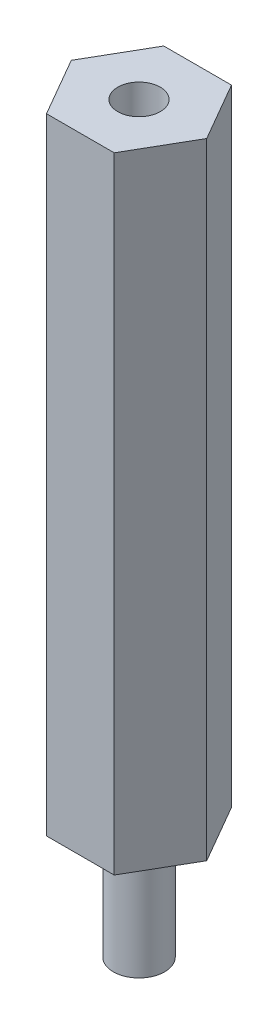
SolidWorks part; units mm, degrees
ref_plane "Front" through (0, 0, 0) normal (0, 0, 1) x (1, 0, 0)
ref_plane "Top" through (0, 0, 0) normal (0, 1, 0) x (1, 0, 0)
ref_plane "Right" through (0, 0, 0) normal (1, 0, 0) x (0, 0, -1)
sketch "Sketch1" plane through (0, 0, 0) normal (0, 1, 0) x (1, 0, 0)
  line L1 (5.4993, 0) -> (2.7496, 4.7625)
  line L2 (2.7496, 4.7625) -> (-2.7496, 4.7625)
  line L3 (-2.7496, 4.7625) -> (-5.4993, 0)
  line L4 (-5.4993, 0) -> (-2.7496, -4.7625)
  line L5 (-2.7496, -4.7625) -> (2.7496, -4.7625)
  line L6 (2.7496, -4.7625) -> (5.4993, 0)
  circle A1 centre (0, 0) radius 4.7625 construction
  dimension "D1" = 9.525
extrude "Base-Extrude" add sketch "Sketch1" along normal blind 50.8
sketch "Sketch2" plane through (0, 0, 0) normal (0, -1, 0) x (1, 0, 0)
  circle A0 centre (0, 0) radius 2.0828
  dimension "D1" = 4.1656
extrude "Extrude1" add sketch "Sketch2" along normal blind 9.525
hole_wizard "#8-32 Tapped Hole1" positions "Sketch4" profile "Sketch3" tap size "#8-32" standard "Ansi Inch"
sketch "Sketch4" plane through (0, 50.8, 0) normal (0, 1, 0) x (-1, 0, 0)
  point P0 (0, 0)
sketch "Sketch3" plane through (0, 50.8, 0) normal (1, 0, 0) x (0, 0, 1)
  line L0 (0, 0) -> (0, 14.9062)
  line L1 (0, 14.9062) -> (1.7272, 13.8684)
  line L2 (1.7272, 13.8684) -> (1.7272, 0)
  line L5 (1.7272, 0) -> (0, 0)
  line L10 (0, 14.9062) -> (-1.7272, 13.8684) construction
  line L11 (0, -6.35) -> (0, 107.95) construction
  dimension "Tap Drill Dia." = 3.4544
  dimension "Tap Drill Depth" = 13.8684
  dimension "Drill Angle" = 118
